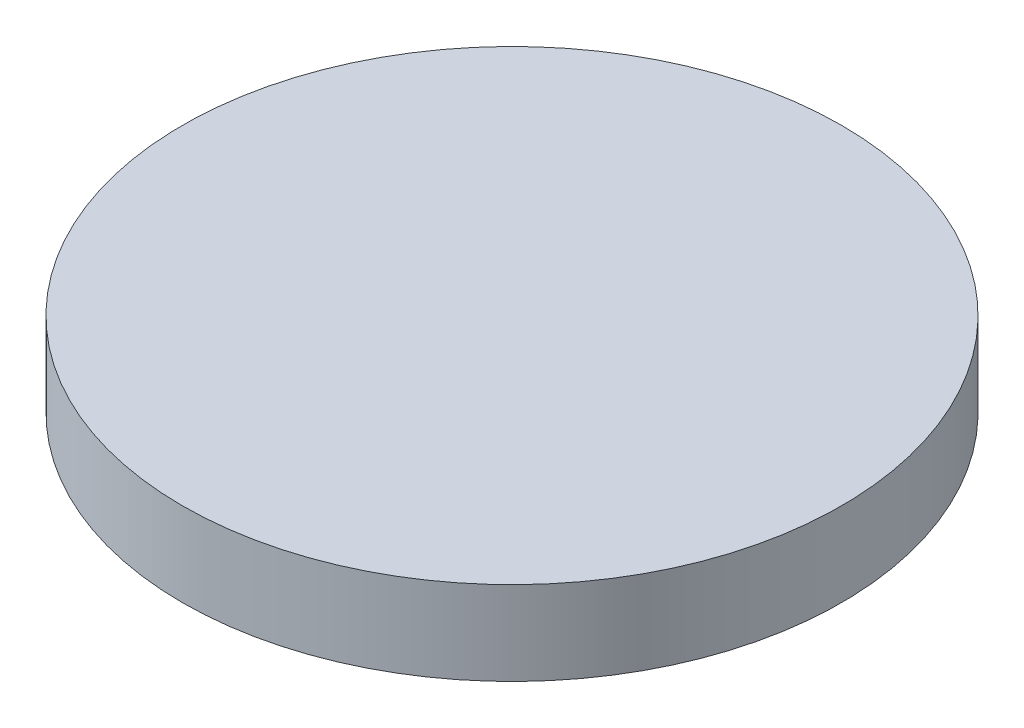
SolidWorks part; units mm, degrees
ref_plane "前视基准面" through (0, 0, 0) normal (0, 0, 1) x (1, 0, 0)
ref_plane "上视基准面" through (0, 0, 0) normal (0, 1, 0) x (1, 0, 0)
ref_plane "右视基准面" through (0, 0, 0) normal (1, 0, 0) x (0, 0, -1)
sketch "草图1" plane through (0, 0, 0) normal (0, 1, 0) x (1, 0, 0)
  circle A0 centre (0, 0) radius 550
  dimension "D1" = 1100
extrude "凸台-拉伸1" add sketch "草图1" along normal blind 140
